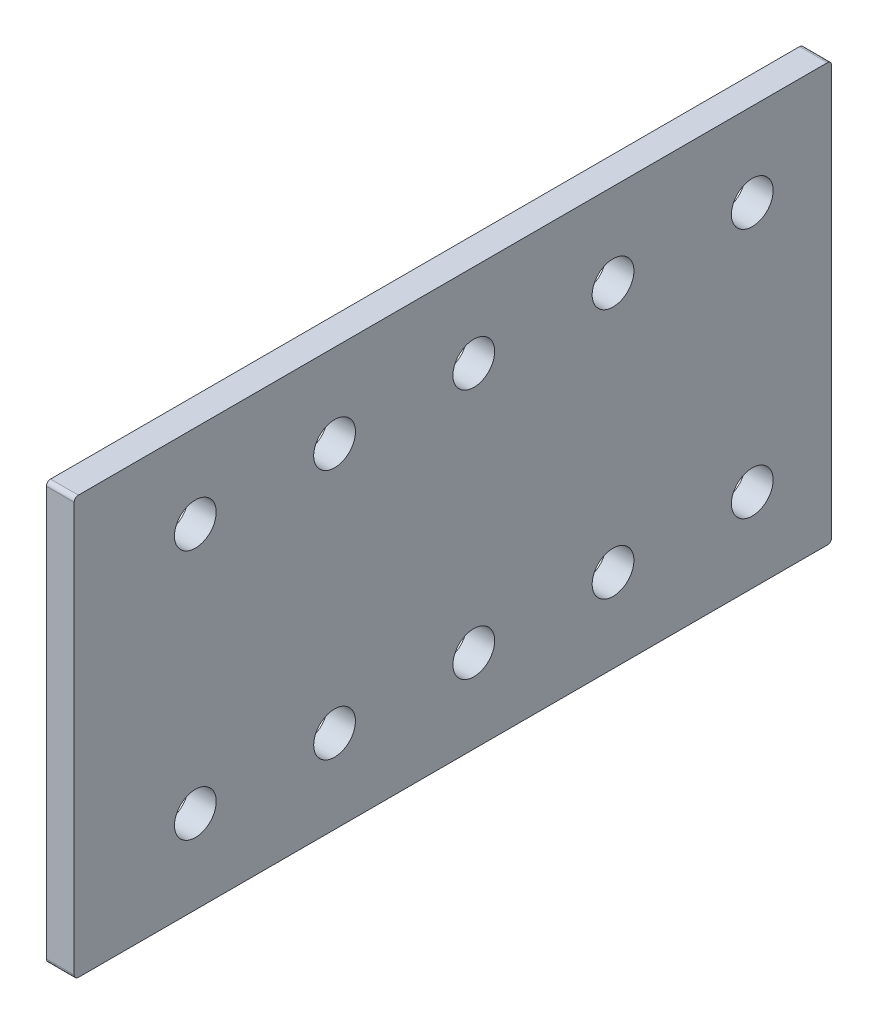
SolidWorks part; units mm, degrees
ref_plane "Płaszczyzna przednia" through (0, 0, 0) normal (0, 0, 1) x (1, 0, 0)
ref_plane "Płaszczyzna górna" through (0, 0, 0) normal (0, 1, 0) x (1, 0, 0)
ref_plane "Płaszczyzna prawa" through (0, 0, 0) normal (1, 0, 0) x (0, 0, -1)
sketch "Szkic13" plane through (0, 0, 0) normal (-1, 0, 0) x (0, 0, 1)
  line L0 (251, 12.2492) -> (251, -110) construction
  line L1 (-263, -150) -> (281, -150)
  line L2 (-263, -150) -> (-263, 150)
  line L3 (-263, 150) -> (281, 150)
  line L4 (281, -150) -> (281, 150)
  line L5 (-263, -150) -> (281, 150) construction
  line L6 (-263, 150) -> (281, -150) construction
  line L10 (281, 0) -> (-260.8471, 0) construction
  line L11 (281, -90) -> (-263, -90) construction
  line L14 (131, -60) -> (131, -198.4657) construction
  line L16 (-6, -90) -> (-6, -234.9657) construction
  line L19 (194, -90) -> (194, -224.2157) construction
  line L20 (62.5, -46.3443) -> (62.5, -62.7989) construction
  line L21 (-74.5, -60) -> (-74.5, -198.4657) construction
  circle A0 centre (-6, -90) radius 15
  circle A1 centre (194, -90) radius 15
  circle A2 centre (94, -90) radius 15
  circle A3 centre (94, 90) radius 15
  circle A4 centre (194, 90) radius 15
  circle A5 centre (-6, 90) radius 15
  circle A6 centre (-206, -90) radius 15
  circle A7 centre (-106, -90) radius 15
  circle A8 centre (-106, 90) radius 15
  circle A9 centre (-206, 90) radius 15
  point P4 (9, 0)
extrude "Dodanie-wyciągnięcie1" add sketch "Szkic13" along normal blind 20 separate body
fillet "Zaokrąglenie1" radius 3 4 edges at (-10, 150, 281) (-10, -150, 281) (-10, -150, -263) (-10, 150, -263)
equation "\"D7@Szkic13\"=350+194"
